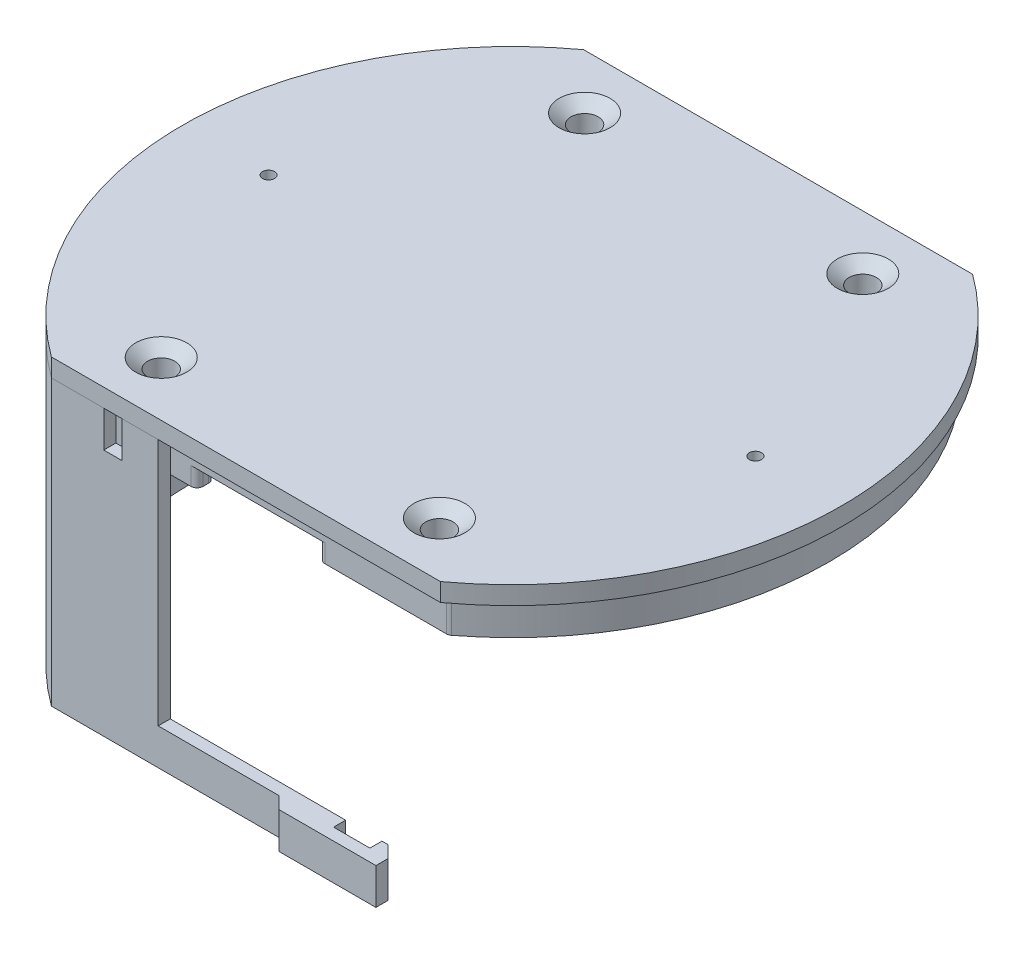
SolidWorks part; units mm, degrees
other "<a1_t42>-<<a_base_t42>-<#8 Clearance Hole1>>"
ref_plane "Front Plane" through (0, 0, 0) normal (0, 0, 1) x (1, 0, 0)
ref_plane "Top Plane" through (0, 0, 0) normal (0, 1, 0) x (1, 0, 0)
ref_plane "Right Plane" through (0, 0, 0) normal (1, 0, 0) x (0, 0, -1)
sketch "Sketch1-a1_t42" plane through (0, 0, 0) normal (0, -1, 0) x (1, 0, 0)
  circle A4 centre (-23, 35) radius 2.2479
  circle A5 centre (23, 35) radius 2.2479
  circle A6 centre (23, -35) radius 2.2479
  circle A7 centre (-23, -35) radius 2.2479
  circle A8 centre (-23, 35) radius 5.2479
  circle A9 centre (23, 35) radius 5.2479
  circle A10 centre (23, -35) radius 5.2479
  circle A11 centre (-23, -35) radius 5.2479
  dimension "D1" = 3
sketch "Sketch2-a1_t42" plane through (0, 0, 0) normal (0, -1, 0) x (1, 0, 0)
  line L0 (29.4321, 36) -> (-29.4321, 36)
  line L1 (-29.4321, -36) -> (29.4321, -36)
  line L4 (31.5, 42) -> (-31.5, 42)
  line L5 (-31.5, -42) -> (31.5, -42)
  arc A0 (-29.4321, 36) -> (-29.4321, -36) centre (0, 0) ccw
  arc A1 (29.4321, -36) -> (29.4321, 36) centre (0, 0) ccw
  arc A4 (31.5, -42) -> (31.5, 42) centre (0, 0) ccw
  arc A5 (-31.5, 42) -> (-31.5, -42) centre (0, 0) ccw
  dimension "D2" = 6
sketch "Sketch3-a1_t42" plane through (0, 3, 0) normal (0, 1, 0) x (1, 0, 0)
  circle A4 centre (23, -35) radius 2.2479
  circle A5 centre (-23, -35) radius 2.2479
  circle A6 centre (-23, 35) radius 2.2479
  circle A7 centre (23, 35) radius 2.2479
sketch "Sketch4-a1_t42" plane through (0, 3, 0) normal (0, 1, 0) x (1, 0, 0)
  line L1 (-32.1598, -44) -> (32.1598, -44)
  line L2 (32.1598, 44) -> (-32.1598, 44)
  line L5 (-31.5, -42) -> (31.5, -42)
  line L6 (31.5, 42) -> (-31.5, 42)
  arc A0 (32.1598, -44) -> (32.1598, 44) centre (0, 0) ccw
  arc A1 (-32.1598, 44) -> (-32.1598, -44) centre (0, 0) ccw
  arc A4 (31.5, -42) -> (31.5, 42) centre (0, 0) ccw
  arc A5 (-31.5, 42) -> (-31.5, -42) centre (0, 0) ccw
  dimension "D2" = 2
sketch "Sketch5-a1_t42" plane through (0, -3, 0) normal (0, -1, 0) x (1, 0, 0)
  line L0 (30.5094, 39.075) -> (-30.5094, 39.075)
  line L1 (-30.5094, -39.075) -> (30.5094, -39.075)
  line L4 (-31.5, -42) -> (31.5, -42)
  line L5 (31.5, 42) -> (-31.5, 42)
  arc A0 (-30.5094, 39.075) -> (-30.5094, -39.075) centre (0, 0) ccw
  arc A1 (30.5094, -39.075) -> (30.5094, 39.075) centre (0, 0) ccw
  arc A4 (31.5, -42) -> (31.5, 42) centre (0, 0) ccw
  arc A5 (-31.5, 42) -> (-31.5, -42) centre (0, 0) ccw
  dimension "D2" = 2.925
sketch "Sketch6-a1_t42" plane through (0, -6, 0) normal (0, -1, 0) x (1, 0, 0)
  line L0 (0, 42) -> (0, 0) construction
  line L2 (0, 0) -> (52.5, 0) construction
  line L4 (-10.075, 42) -> (10.075, 42)
  line L5 (-10.075, 42) -> (-10.075, 39.075)
  line L6 (-10.075, 39.075) -> (10.075, 39.075)
  line L7 (10.075, 42) -> (10.075, 39.075)
  line L8 (-10.075, -42) -> (-10.075, -39.075)
  line L9 (-10.075, -39.075) -> (10.075, -39.075)
  line L10 (10.075, -42) -> (10.075, -39.075)
  line L11 (-10.075, -42) -> (10.075, -42)
  dimension "D1" = 20.15
sketch "Sketch9-a1_t42" [suppressed] plane through (0, 3, 0) normal (0, 1, 0) x (1, 0, 0)
  line L0 (0, -44) -> (0, 44) construction
  line L3 (0, 0) -> (-54.5, 0) construction
  line L4 (41.75, -15.95) -> (41.75, 15.95)
  line L5 (-41.75, -15.95) -> (-12.0751, -15.95)
  line L6 (-41.75, -15.95) -> (-41.75, 15.95)
  line L7 (-41.75, 15.95) -> (-12.0751, 15.95)
  line L8 (-12.0751, -15.95) -> (-12.0751, 15.95)
  line L9 (41.75, 15.95) -> (12.0751, 15.95)
  line L10 (12.0751, -15.95) -> (12.0751, 15.95)
  line L11 (41.75, -15.95) -> (12.0751, -15.95)
  point P17 (-38.75, 0)
  dimension "D2" = 31.9
  dimension "D3" = 38.75
  dimension "D4" = 26.6749
sketch "Sketch10-a1_t42" [suppressed] plane through (0, 0, 0) normal (0, -1, 0) x (1, 0, 0)
  line L0 (0, -36) -> (0, 0) construction
  line L3 (-8.0751, -15.95) -> (-45.75, -15.95)
  line L4 (-8.0751, -15.95) -> (-8.0751, 15.95)
  line L5 (-8.0751, 15.95) -> (-45.75, 15.95)
  line L6 (-45.75, -15.95) -> (-45.75, 15.95)
  line L10 (-5.0751, -18.95) -> (-48.75, -18.95)
  line L11 (-48.75, -18.95) -> (-48.75, 18.95)
  line L12 (-5.0751, 18.95) -> (-48.75, 18.95)
  line L13 (-5.0751, -18.95) -> (-5.0751, 18.95)
  line L14 (8.0751, -15.95) -> (8.0751, 15.95)
  line L15 (8.0751, 15.95) -> (45.75, 15.95)
  line L16 (45.75, -15.95) -> (45.75, 15.95)
  line L17 (8.0751, -15.95) -> (45.75, -15.95)
  line L18 (5.0751, -18.95) -> (5.0751, 18.95)
  line L19 (5.0751, 18.95) -> (48.75, 18.95)
  line L20 (48.75, -18.95) -> (48.75, 18.95)
  line L21 (5.0751, -18.95) -> (48.75, -18.95)
sketch "Sketch11-a1_t42" [suppressed] plane through (0, -3, 0) normal (0, -1, 0) x (1, 0, 0)
  line L1 (41.75, -15.95) -> (41.75, 15.95)
  line L2 (0, 0) -> (0, -36) construction
  line L4 (41.75, -15.95) -> (45.75, -15.95)
  line L5 (45.75, -15.95) -> (45.75, 15.95)
  line L6 (45.75, 15.95) -> (41.75, 15.95)
  line L8 (-45.75, 15.95) -> (-41.75, 15.95)
  line L9 (-45.75, -15.95) -> (-45.75, 15.95)
  line L10 (-41.75, -15.95) -> (-45.75, -15.95)
  line L11 (-41.75, -15.95) -> (-41.75, 15.95)
sketch "Sketch12-a1_t42" [suppressed] plane through (0, 3, 0) normal (0, 1, 0) x (1, 0, 0)
  line L0 (0, -44) -> (0, 0) construction
  line L2 (0, 0) -> (54.5, 0) construction
  line L3 (-41.75, -15.95) -> (-41.75, 15.95)
  line L4 (41.75, -15.95) -> (20.85, -15.95)
  line L5 (41.75, -15.95) -> (41.75, 15.95)
  line L6 (41.75, 15.95) -> (20.85, 15.95)
  line L7 (20.85, -15.95) -> (20.85, 15.95)
  line L8 (-41.75, 15.95) -> (-20.85, 15.95)
  line L9 (-20.85, -15.95) -> (-20.85, 15.95)
  line L10 (-41.75, -15.95) -> (-20.85, -15.95)
  point P15 (30, 0)
  dimension "D2" = 31.9
  dimension "D3" = 30
  dimension "D4" = 9.15
sketch "Sketch13-a1_t42" [suppressed] plane through (0, 0, 0) normal (0, -1, 0) x (1, 0, 0)
  line L0 (0, 0) -> (0, -44) construction
  line L3 (-16.85, -15.95) -> (-45.75, -15.95)
  line L4 (-16.85, -15.95) -> (-16.85, 15.95)
  line L5 (-16.85, 15.95) -> (-45.75, 15.95)
  line L6 (-45.75, -15.95) -> (-45.75, 15.95)
  line L10 (-13.85, -18.95) -> (-48.75, -18.95)
  line L11 (-48.75, -18.95) -> (-48.75, 18.95)
  line L12 (-13.85, 18.95) -> (-48.75, 18.95)
  line L13 (-13.85, -18.95) -> (-13.85, 18.95)
  line L14 (16.85, -15.95) -> (16.85, 15.95)
  line L15 (16.85, 15.95) -> (45.75, 15.95)
  line L16 (45.75, -15.95) -> (45.75, 15.95)
  line L17 (16.85, -15.95) -> (45.75, -15.95)
  line L18 (13.85, -18.95) -> (13.85, 18.95)
  line L19 (13.85, 18.95) -> (48.75, 18.95)
  line L20 (48.75, -18.95) -> (48.75, 18.95)
  line L21 (13.85, -18.95) -> (48.75, -18.95)
sketch "Sketch14-a1_t42" [suppressed] plane through (0, -3, 0) normal (0, -1, 0) x (1, 0, 0)
  line L2 (41.75, -15.95) -> (41.75, 15.95)
  line L3 (0, 0) -> (0, -53.8767) construction
  line L5 (41.75, -15.95) -> (45.75, -15.95)
  line L6 (45.75, -15.95) -> (45.75, 15.95)
  line L7 (45.75, 15.95) -> (41.75, 15.95)
  line L9 (-45.75, 15.95) -> (-41.75, 15.95)
  line L10 (-45.75, -15.95) -> (-45.75, 15.95)
  line L11 (-41.75, -15.95) -> (-45.75, -15.95)
  line L12 (-41.75, -15.95) -> (-41.75, 15.95)
sketch "Sketch15-a1_t42" [suppressed] plane through (0, 3, 0) normal (0, 1, 0) x (1, 0, 0)
  line L0 (0, -44) -> (0, 0) construction
  line L1 (41.825, -15.95) -> (-41.825, -15.95)
  line L2 (41.825, -15.95) -> (41.825, 15.95)
  line L3 (41.825, 15.95) -> (-41.825, 15.95)
  line L4 (-41.825, -15.95) -> (-41.825, 15.95)
  line L6 (0, 0) -> (54.5, 0) construction
  dimension "D2" = 31.9
sketch "Sketch16-a1_t42" [suppressed] plane through (0, 0, 0) normal (0, -1, 0) x (1, 0, 0)
  line L0 (0, 0) -> (0, -56.5235) construction
  line L1 (45.825, -15.95) -> (-45.825, -15.95)
  line L2 (45.825, -15.95) -> (45.825, 15.95)
  line L3 (45.825, 15.95) -> (-45.825, 15.95)
  line L4 (-45.825, -15.95) -> (-45.825, 15.95)
  line L8 (48.825, -18.95) -> (-48.825, -18.95)
  line L9 (-48.825, -18.95) -> (-48.825, 18.95)
  line L10 (48.825, 18.95) -> (-48.825, 18.95)
  line L11 (48.825, -18.95) -> (48.825, 18.95)
sketch "Sketch17-a1_t42" [suppressed] plane through (0, 0, 0) normal (0, -1, 0) x (1, 0, 0)
  line L1 (41.825, -15.95) -> (41.825, 15.95)
  line L2 (0, 0) -> (0, -52.1923) construction
  line L3 (41.825, -15.95) -> (45.825, -15.95)
  line L4 (45.825, -15.95) -> (45.825, 15.95)
  line L5 (45.825, 15.95) -> (41.825, 15.95)
  line L7 (-45.825, 15.95) -> (-41.825, 15.95)
  line L8 (-45.825, -15.95) -> (-45.825, 15.95)
  line L9 (-41.825, -15.95) -> (-45.825, -15.95)
  line L10 (-41.825, -15.95) -> (-41.825, 15.95)
inserted part "a1_t42"
sketch "Sketch12" plane through (0, 0, 0) normal (0, -1, 0) x (1, 0, 0)
  line L3 (-32.1598, -44) -> (32.1598, -44)
  line L4 (32.1598, 44) -> (-32.1598, 44)
  line L5 (-32.1598, -44) -> (32.1598, -44)
  line L6 (32.1598, 44) -> (-32.1598, 44)
  line L7 (-31.1649, -42) -> (31.1649, -42)
  line L8 (31.1649, 42) -> (-31.1649, 42)
  line L9 (-31.1649, -42) -> (31.1649, -42)
  line L10 (31.1649, 42) -> (-31.1649, 42)
  arc A2 (-32.1598, 44) -> (-32.1598, -44) centre (0, 0) ccw
  arc A3 (32.1598, -44) -> (32.1598, 44) centre (0, 0) ccw
  arc A4 (-32.1598, 44) -> (-32.1598, -44) centre (0, 0) ccw
  arc A5 (32.1598, -44) -> (32.1598, 44) centre (0, 0) ccw
  arc A10 (31.77, -41.7961) -> (31.77, 41.7961) centre (0, 0) ccw
  arc A11 (31.1649, -42) -> (31.77, -41.7961) centre (31.1649, -41) ccw
  arc A12 (-31.77, -41.7961) -> (-31.1649, -42) centre (-31.1649, -41) ccw
  arc A13 (-31.77, 41.7961) -> (-31.77, -41.7961) centre (0, 0) ccw
  arc A14 (-31.1649, 42) -> (-31.77, 41.7961) centre (-31.1649, 41) ccw
  arc A15 (31.77, 41.7961) -> (31.1649, 42) centre (31.1649, 41) ccw
  arc A16 (31.77, -41.7961) -> (31.77, 41.7961) centre (0, 0) ccw
  arc A17 (31.1649, -42) -> (31.77, -41.7961) centre (31.1649, -41) ccw
  arc A18 (-31.77, -41.7961) -> (-31.1649, -42) centre (-31.1649, -41) ccw
  arc A19 (-31.77, 41.7961) -> (-31.77, -41.7961) centre (0, 0) ccw
  arc A20 (-31.1649, 42) -> (-31.77, 41.7961) centre (-31.1649, 41) ccw
  arc A21 (31.77, 41.7961) -> (31.1649, 42) centre (31.1649, 41) ccw
  dimension "D1" = 0
  dimension "D2" = 0
extrude "Shell Body" add sketch "Sketch12" along normal blind 47 separate body
sketch "Sketch13" plane through (0, 0, 44) normal (0, 0, 1) x (1, 0, 0)
  line L0 (0, 0) -> (0, -47) construction
  line L3 (-70.9867, -23.5) -> (0, -23.5) construction
  line L5 (32.1598, 0) -> (-32.1598, 0) construction
  line L6 (-14.5, -6) -> (14.5, -6)
  line L7 (-14.5, -6) -> (-14.5, -41)
  line L8 (-14.5, -41) -> (14.5, -41)
  line L9 (14.5, -6) -> (14.5, -41)
  line L10 (32.1598, -47) -> (-32.1598, -47) construction
  dimension "D1" = 6
  dimension "D2" = 29
extrude "Clearance - Fan" cut sketch "Sketch13" against normal up to surface (2 mm away)
sketch "Sketch14" plane through (0, 0, 44) normal (0, 0, 1) x (1, 0, 0)
  line L0 (32.1598, 0) -> (-32.1598, 0) construction
  line L2 (-14.5, 0) -> (54.5, 0)
  line L3 (-14.5, 0) -> (-14.5, -41)
  line L4 (-14.5, -41) -> (14.5, -41) construction
  line L5 (54.5, 0) -> (54.5, -47)
  line L8 (-14.5, -6) -> (-14.5, -41) construction
  line L9 (54.5, 0) -> (32.1598, 0) construction
  line L10 (54.5, 0) -> (32.1598, 0) construction
  line L11 (-14.5, -41) -> (14.5, -41)
  line L12 (14.5, -41) -> (14.5, -47)
  line L13 (32.1598, -47) -> (-32.1598, -47) construction
  line L14 (14.5, -47) -> (54.5, -47)
extrude "Clearance - Side 1" cut sketch "Sketch14" against normal up to surface (86 mm away)
sketch "Sketch16" plane through (0, 0, 0) normal (0, 1, 0) x (1, 0, 0)
  line L0 (0, 0) -> (0, 44) construction
  line L2 (-32.1598, 44) -> (32.1598, 44) construction
  line L4 (0, 44) -> (34.7311, 44)
  line L5 (0, 44) -> (0, 42)
  line L6 (0, 42) -> (34.7311, 42)
  line L7 (34.7311, 44) -> (34.7311, 42)
extrude "Clearance - Side 2" cut sketch "Sketch16" against normal through all
sketch "Sketch17" plane through (0, 0, 44) normal (0, 0, 1) x (1, 0, 0)
  line L1 (-20.5, 0) -> (-23.5, 0)
  line L2 (-20.5, 0) -> (-20.5, -6)
  line L3 (-20.5, -6) -> (-23.5, -6)
  line L4 (-23.5, 0) -> (-23.5, -6)
  line L5 (-14.5, 0) -> (-32.1598, 0) construction
  dimension "D1" = 6
  dimension "D2" = 6
  dimension "D3" = 3
extrude "Clearance - Clip 1" cut sketch "Sketch17" against normal up to next
sketch "Sketch18" plane through (0, 0, -42) normal (0, 0, 1) x (1, 0, 0)
  line L1 (-6, 0) -> (-9, 0)
  line L2 (-6, 0) -> (-6, -6)
  line L3 (-6, -6) -> (-9, -6)
  line L4 (-9, 0) -> (-9, -6)
  line L8 (-23.5, 0) -> (-23.5, -6) construction
  line L9 (-23.5, -6) -> (-20.5, -6) construction
  line L10 (-31.1649, 0) -> (0, 0) construction
  dimension "D1" = 6
extrude "Clearance - Clip 2" cut sketch "Sketch18" against normal through all
sketch "Sketch19" plane through (0, -47, 0) normal (0, -1, 0) x (1, 0, 0)
  line L0 (5.5, 44) -> (5.5, 46)
  line L2 (5.5, 46) -> (23.5, 46)
  line L3 (23.5, 46) -> (23.5, 42)
  line L4 (23.5, 42) -> (20.5, 42)
  line L5 (20.5, 42) -> (20.5, 44)
  line L6 (20.5, 44) -> (5.5, 44)
  line L9 (-9, -44) -> (6, -44)
  line L11 (6, -44) -> (6, -42)
  line L12 (6, -42) -> (9, -42)
  line L13 (9, -42) -> (9, -46)
  line L14 (9, -46) -> (-9, -46)
  line L15 (-9, -46) -> (-9, -44)
  line L16 (14.5, 42) -> (-31.1649, 42) construction
  line L17 (14.5, 42) -> (14.5, 44) construction
  line L18 (14.5, 44) -> (-32.1598, 44) construction
  line L19 (-32.1598, -44) -> (0, -44) construction
  dimension "D1" = 2
  dimension "D2" = 9
  dimension "D3" = 6
  dimension "D4" = 3
  dimension "D5" = 9
extrude "Tabs" add sketch "Sketch19" against normal up to surface (6 mm away)
chamfer "Tab Chamfers" distance 2 angle 45 4 edges at (-9, -44, -46) (9, -44, -42) (23.5, -44, 42) (5.5, -44, 46)
ref_point "Point1"
equation "\"D1@Sketch13\"=2*\"width keep@values@params_print.SLDPRT\""
equation "\"D1@Sketch17\" = \"width keep@values@params_print.SLDPRT\" * 2"
equation "\"D2@Sketch17\"=\"D1@Sketch17\""
equation "\"D3@Sketch17\"=\"width keep@values@params_print.SLDPRT\""
equation "\"D1@Sketch18\"=2*\"width keep@values@params_print.SLDPRT\""
equation "\"D3@Sketch19\"=2*\"width keep@values@params_print.SLDPRT\""
equation "\"D4@Sketch19\"=\"width keep@values@params_print.SLDPRT\""
equation "\"D5@Sketch19\"=\"D2@Sketch19\""
